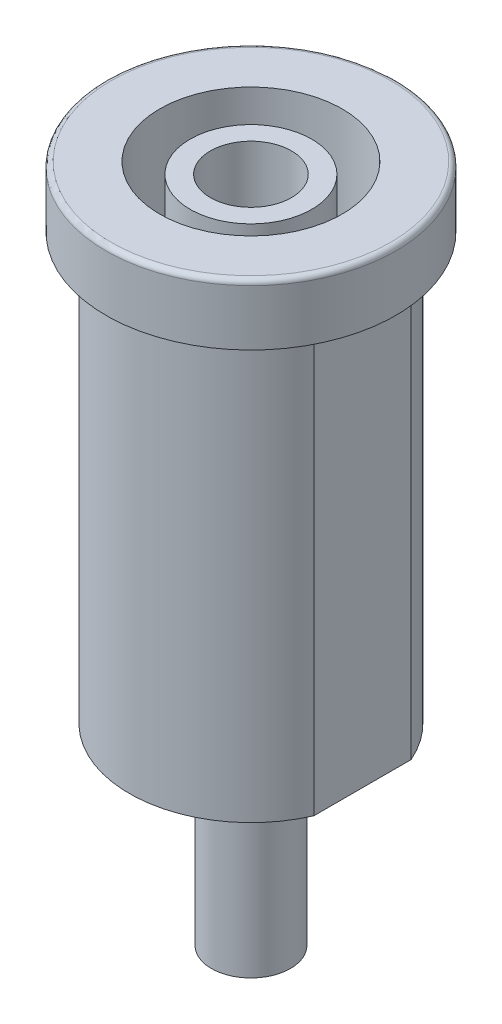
SolidWorks part; units mm, degrees
ref_plane "Plan de face" through (0, 0, 0) normal (0, 0, 1) x (1, 0, 0)
ref_plane "Plan de dessus" through (0, 0, 0) normal (0, 1, 0) x (1, 0, 0)
ref_plane "Plan de droite" through (0, 0, 0) normal (1, 0, 0) x (0, 0, -1)
sketch "Esquisse1" plane through (0, 0, 0) normal (0, 0, 1) x (1, 0, 0)
  line L0 (0, 5.9642) -> (0, -16.3975) construction
  line L1 (0, -16.3975) -> (-6, -16.3975)
  line L2 (-6, -16.3975) -> (-6, 4.6025)
  line L3 (-6, 4.6025) -> (-7.15, 4.6025)
  line L4 (-7.15, 4.6025) -> (-7.15, 7.3525)
  line L5 (-6.9, 7.6025) -> (-4.5, 7.6025)
  line L6 (-4.5, 7.6025) -> (-4.5, -14.3975)
  line L7 (-4.5, -14.3975) -> (-3, -14.3975)
  line L8 (-3, -14.3975) -> (-3, 7.0578)
  line L9 (-3, 7.0578) -> (-2, 7.0578)
  line L10 (-2, 7.0578) -> (-2, -12.3975)
  line L11 (-2, -12.3975) -> (0, -12.3975)
  line L12 (0, -12.3975) -> (0, -16.3975)
  arc A0 (-7.15, 7.3525) -> (-6.9, 7.6025) centre (-6.9, 7.3525) cw
  point P13 (-6, -5.8975)
  point P15 (-6.575, 4.6025)
  dimension "D10" = 0.25
  dimension "D1" = 7.15
  dimension "D2" = 6
  dimension "D3" = 3
  dimension "D4" = 4.5
  dimension "D5" = 4
  dimension "D6" = 1
  dimension "D7" = 24
  dimension "D8" = 2
  dimension "D9" = 4
revolve "Révolution1" add sketch "Esquisse1" angle 360 about L0
sketch "Esquisse2" plane through (0, -16.3975, 0) normal (0, -1, 0) x (1, 0, 0)
  circle A0 centre (0, 0) radius 1.95
  dimension "D1" = 3.9
extrude "Boss.-Extru.1" add sketch "Esquisse2" along normal blind 9.5
sketch "Esquisse3" plane through (0, -16.3975, 0) normal (0, -1, 0) x (1, 0, 0)
  line L1 (-7.1146, 6.4105) -> (-5.5, 6.4105)
  line L2 (-7.1146, 6.4105) -> (-7.1146, -7.3716)
  line L3 (-7.1146, -7.3716) -> (-5.5, -7.3716)
  line L4 (-5.5, 6.4105) -> (-5.5, -7.3716)
  line L5 (5.5, 6.9872) -> (9.6135, 6.9872)
  line L6 (5.5, 6.9872) -> (5.5, -7.8137)
  line L7 (5.5, -7.8137) -> (9.6135, -7.8137)
  line L8 (9.6135, 6.9872) -> (9.6135, -7.8137)
  dimension "D1" = 5.5
  dimension "D2" = 5.5
extrude "Enlèv. mat.-Extru.1" cut sketch "Esquisse3" against normal up to surface (21 mm away)
